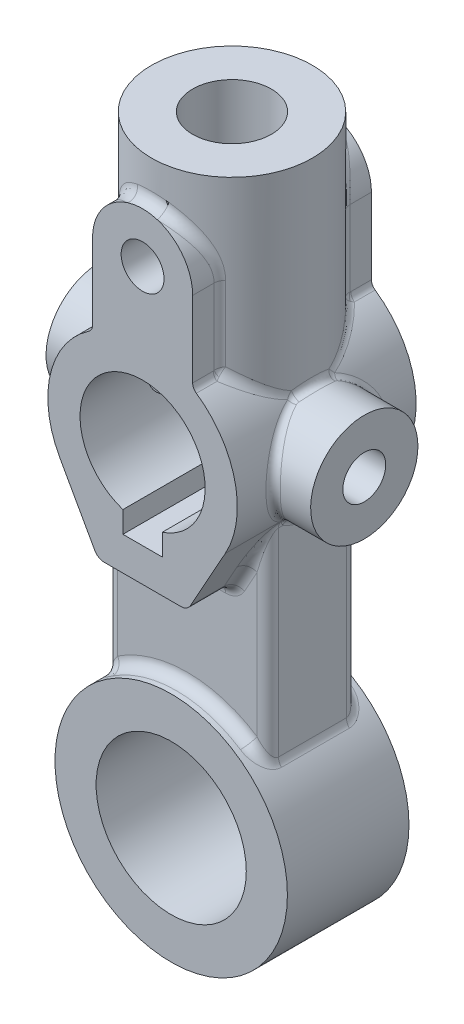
SolidWorks part; units mm, degrees
ref_plane "Front" through (0, 0, 0) normal (0, 0, 1) x (1, 0, 0)
ref_plane "Top" through (0, 0, 0) normal (0, 1, 0) x (1, 0, 0)
ref_plane "Right" through (0, 0, 0) normal (1, 0, 0) x (0, 0, -1)
sketch "Sketch1" plane through (0, 0, 0) normal (0, 0, 1) x (1, 0, 0)
  line L0 (0, 0) -> (0, 45) construction
  line L1 (14, 22.5) -> (14, 45)
  line L2 (-14, 22.5) -> (-14, 45)
  line L3 (-12.5, -32) -> (12.5, -32)
  line L4 (12.5, -32) -> (23.1461, -12.9039)
  line L5 (-12.5, -32) -> (-23.1461, -12.9039)
  line L6 (0, 0) -> (0, -32) construction
  arc A0 (23.1461, -12.9039) -> (14, 22.5) centre (0, 0) ccw
  arc A1 (-14, 45) -> (14, 45) centre (0, 45) cw
  arc A2 (-14, 22.5) -> (-23.1461, -12.9039) centre (0, 0) ccw
  dimension "D1" = 14
  dimension "D2" = 45
  dimension "D3" = 53
  dimension "D4" = 32
  dimension "D5" = 25
extrude "Base-Extrude" add sketch "Sketch1" along normal mid plane 50
sketch "Sketch2" plane through (0, 0, 0) normal (0, 1, 0) x (1, 0, 0)
  circle A0 centre (0, 0) radius 22.5
  dimension "D1" = 45
extrude "Boss-Extrude1" add sketch "Sketch2" along normal blind 70
sketch "Sketch3" plane through (0, 0, 0) normal (0, 1, 0) x (1, 0, 0)
  line L0 (0, 0) -> (22.5, 0) construction
  line L1 (-22.5, 12.5) -> (22.5, 12.5)
  line L2 (-22.5, 12.5) -> (-22.5, -12.5)
  line L3 (-22.5, -12.5) -> (22.5, -12.5)
  line L4 (22.5, 12.5) -> (22.5, -12.5)
  circle A0 centre (0, 0) radius 22.5 construction
  dimension "D1" = 25
extrude "Boss-Extrude2" add sketch "Sketch3" against normal blind 95
sketch "Sketch4" plane through (0, 0, 0) normal (0, 0, 1) x (1, 0, 0)
  line L0 (0, 70) -> (0, 22.5) construction
  line L1 (-22.5, -95) -> (22.5, -95) construction
  circle A0 centre (0, -95) radius 32.5
  dimension "D1" = 65
extrude "Boss-Extrude3" add sketch "Sketch4" along normal mid plane 34
sketch "Sketch5" plane through (0, 0, 0) normal (1, 0, 0) x (0, 0, -1)
  circle A0 centre (0, 0) radius 15
  dimension "D1" = 30
extrude "Boss-Extrude4" add sketch "Sketch5" along normal mid plane 74
sketch "Sketch7" plane through (0, 0, 0) normal (0, 0, 1) x (1, 0, 0)
  line L0 (0, 0) -> (0, -22.6132) construction
  line L1 (0, 70) -> (0, 14.5086) construction
  line L2 (-5.5, -22.6132) -> (5.5, -22.6132)
  line L3 (5.5, -22.6132) -> (5.5, -16.6132)
  line L4 (-5.5, -22.6132) -> (-5.5, -16.6132)
  arc A0 (5.5, -16.6132) -> (-5.5, -16.6132) centre (0, 0) ccw
  dimension "D1" = 35
  dimension "D2" = 11
  dimension "D3" = 6
extrude "Cut-Extrude2" cut sketch "Sketch7" against normal through all and the other way through all
sketch "Sketch10" plane through (0, 0, 0) normal (0, 0, 1) x (1, 0, 0)
  line L0 (0, 70) -> (0, 14.5086) construction
  circle A0 centre (0, 45) radius 6
  arc A1 (14, 45) -> (-14, 45) centre (0, 45) ccw construction
  dimension "D1" = 12
extrude "Cut-Extrude5" cut sketch "Sketch10" against normal through all and the other way through all
sketch "Sketch6" plane through (0, 0, 0) normal (1, 0, 0) x (0, 0, -1)
  circle A0 centre (0, 0) radius 6
  dimension "D1" = 12
extrude "Cut-Extrude1" cut sketch "Sketch6" against normal through all and the other way through all
sketch "Sketch8" plane through (0, 70, 0) normal (0, 1, 0) x (-1, 0, 0)
  circle A0 centre (0, 0) radius 11
  dimension "D1" = 22
extrude "Cut-Extrude3" cut sketch "Sketch8" against normal up to next
sketch "Sketch9" plane through (0, 0, 0) normal (0, 0, 1) x (1, 0, 0)
  circle A0 centre (0, -95) radius 21
  dimension "D1" = 42
extrude "Cut-Extrude4" cut sketch "Sketch9" against normal through all and the other way through all
fillet "Rounds" radius 3 8 edges at (12.5, -32, 18.75) (-12.5, -32, 18.75) (12.5, -32, -18.75) (-12.5, -32, -18.75) (-22.5, -42.8053, 12.5) (22.5, -42.8053, 12.5) (22.5, -42.8053, -12.5) (-22.5, -42.8053, -12.5)
fillet "Fillets.1" radius 2.4 4 edges at (-14, 22.5, 21.307) (14, 22.5, 21.307) (14, 22.5, -21.307) (-14, 22.5, -21.307)
fillet "Fillets.2" radius 3 46 edges at (0, -62.5, 12.5) (16.429, -24.9524, 12.5) (0, -32, 12.5) (-16.429, -24.9524, 12.5) (22.5, -14.0627, 7.3596) (22.5, -71.5479, 0) (0, -62.5, -12.5) (-16.429, -24.9524, -12.5) (0, -32, -12.5) (16.429, -24.9524, -12.5) (-22.5, -14.0627, -7.3596) (-22.5, -71.5479, 0) (21.6213, -15.6388, 11.6213) (22.0944, -71.1654, 11.0064) (21.6213, -15.6388, -11.6213) (21.741, -70.8426, -11.4945) (-21.6213, -15.6388, 11.6213) (-21.741, -70.8426, 11.4945) (-21.6213, -15.6388, -11.6213) (-22.0944, -71.1654, -11.0064) (-12.2572, -31.5867, -12.5) (12.2572, -31.5867, -12.5) (-12.2572, -31.5867, 12.5) (12.2572, -31.5867, 12.5) (14, 34.398, -17.6139) (-21.3263, 15.7301, -7.172) (-14, 34.398, 17.6139) (20.174, 17.1831, 9.9628) (-14.151, 22.9583, 17.4929) (-14.3496, 22.5487, -17.3303) (14.151, 22.9583, -17.4929) (14.3496, 22.5487, 17.3303) (14, 34.398, 17.6139) (0.425, 31.0065, -22.496) (-14, 34.398, -17.6139) (0.425, 58.9935, 22.496) (20.6258, 16.638, -8.9902) (-21.7119, 15.1935, 5.9027) (-22.4982, 14.9973, -0.2837) (22.5, -14.0627, -7.3596) (-22.5, -14.0627, 7.3596) (22.7926, -13.5379, -6.4596) (26.0345, -4.945, -14.1615) (-22.7926, -13.5379, 6.4596) (-26.0345, 4.945, -14.1615)
fillet "Fillets.3" radius 2 24 edges at (-22.5, -15, 0) (23.0089, -13.15, -7.2165) (22.5, -15, 0) (26.0345, -4.945, -14.1615) (22.3343, 14.6668, -3.1439) (22.5261, -14.4479, 4.0321) (22.7065, -13.7487, -5.9978) (-23.0089, -13.15, 7.2165) (-26.0345, 4.945, -14.1615) (-22.3394, 14.6864, 3.0512) (-22.7065, -13.7487, 5.9978) (-22.5261, -14.4479, -4.0321) (-21.6561, 16.3665, 6.1043) (21.6561, 16.3665, -6.1043) (-19.5323, 17.9092, -13.3218) (19.5323, 17.9092, 13.3218) (26.4999, 0.0659, -14.9999) (23.0089, -13.15, 7.2165) (-26.4999, -0.0659, -14.9999) (-23.0089, -13.15, -7.2165)
